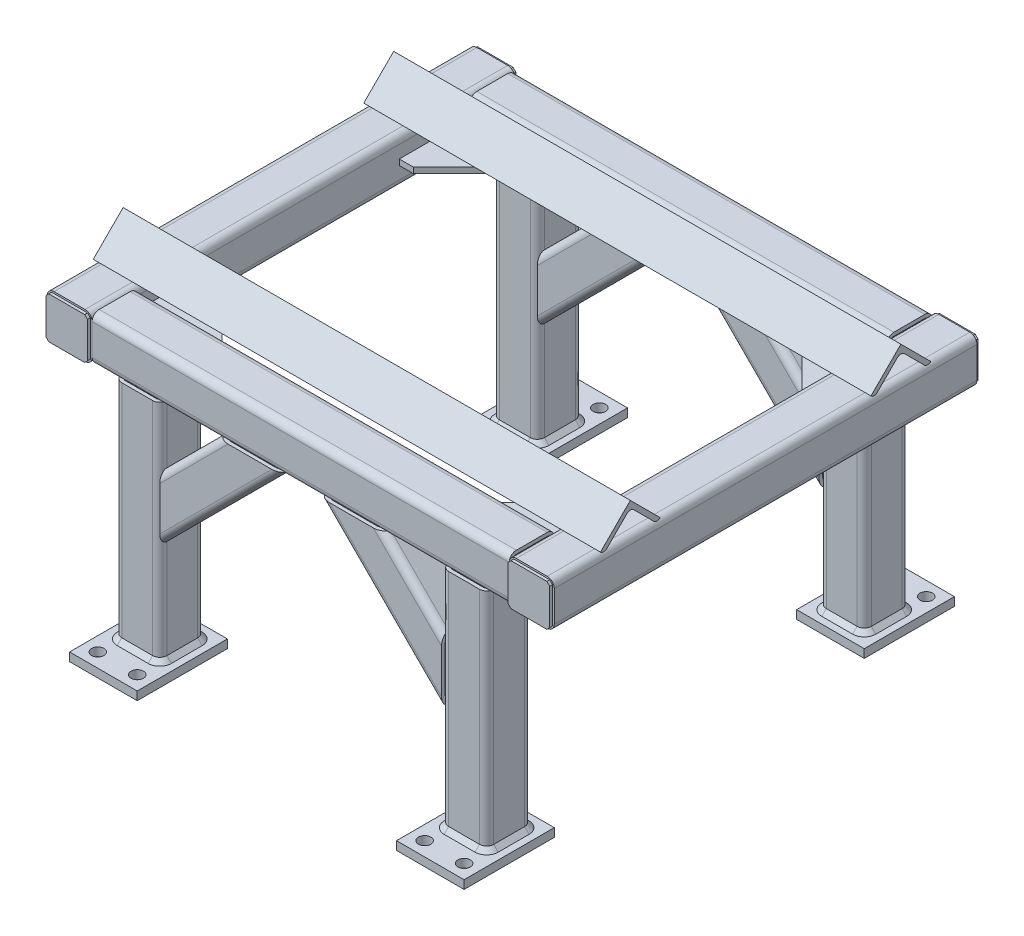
SolidWorks part; units mm, degrees
other "DetailItem1"
other "DetailItem13"
other "DetailItem2"
other "DetailItem3"
other "DetailItem4"
other "DetailItem5"
other "DetailItem6"
other "DetailItem7"
other "DetailItem8"
other "DetailItem9"
other "DetailItem10"
other "DetailItem11"
other "DetailItem12"
other "Weld Folder"
other "Weld Bead1"
other "Weld Bead2"
other "Weld Bead3"
other "Weld Bead4"
other "Weld Bead5"
other "Weld Bead6"
other "Weld Bead7"
other "Weld Bead12"
other "Weld Bead8"
other "Weld Bead9"
other "Weld Bead10"
other "Weld Bead11"
ref_plane "Default Plane" through (350, 20, -275) normal (0, -1, 0) x (-1, 0, 0)
sketch3d "Bounding-Box_BASE PLATES"
  line L0 (120, 0, 0) -> (120, 160, 0) construction
  line L1 (120, 160, 0) -> (0, 160, 0) construction
  line L2 (0, 160, 0) -> (0, 0, 0) construction
  line L3 (0, 0, 0) -> (120, 0, 0) construction
  line L4 (120, 0, 15) -> (120, 160, 15) construction
  line L5 (120, 160, 15) -> (0, 160, 15) construction
  line L6 (0, 160, 15) -> (0, 0, 15) construction
  line L7 (0, 0, 15) -> (120, 0, 15) construction
  line L8 (120, 0, 0) -> (120, 0, 15) construction
  line L9 (120, 160, 0) -> (120, 160, 15) construction
  line L10 (0, 160, 0) -> (0, 160, 15) construction
  line L11 (0, 0, 0) -> (0, 0, 15) construction
ref_plane "Default Plane" through (370, 455, -270) normal (0, 1, 0) x (-1, 0, 0)
sketch3d "Bounding-Box_GUSSETS"
  line L0 (125, -25, 0) -> (125, 100, 0) construction
  line L1 (125, 100, 0) -> (0, 100, 0) construction
  line L2 (0, 100, 0) -> (0, -25, 0) construction
  line L3 (0, -25, 0) -> (125, -25, 0) construction
  line L4 (125, -25, 10) -> (125, 100, 10) construction
  line L5 (125, 100, 10) -> (0, 100, 10) construction
  line L6 (0, 100, 10) -> (0, -25, 10) construction
  line L7 (0, -25, 10) -> (125, -25, 10) construction
  line L8 (125, -25, 0) -> (125, -25, 10) construction
  line L9 (125, 100, 0) -> (125, 100, 10) construction
  line L10 (0, 100, 0) -> (0, 100, 10) construction
  line L11 (0, -25, 0) -> (0, -25, 10) construction
ref_plane "Default Plane" through (446.85, 491.85, -380) normal (0, 0, 1) x (1, 0, 0)
sketch3d "Bounding-Box_END CAPS"
  line L0 (-73.7, -68.7, 0) -> (0, -68.7, 0) construction
  line L1 (0, -68.7, 0) -> (0, 5, 0) construction
  line L2 (0, 5, 0) -> (-73.7, 5, 0) construction
  line L3 (-73.7, 5, 0) -> (-73.7, -68.7, 0) construction
  line L4 (-73.7, -68.7, 5) -> (0, -68.7, 5) construction
  line L5 (0, -68.7, 5) -> (0, 5, 5) construction
  line L6 (0, 5, 5) -> (-73.7, 5, 5) construction
  line L7 (-73.7, 5, 5) -> (-73.7, -68.7, 5) construction
  line L8 (-73.7, -68.7, 0) -> (-73.7, -68.7, 5) construction
  line L9 (0, -68.7, 0) -> (0, -68.7, 5) construction
  line L10 (0, 5, 0) -> (0, 5, 5) construction
  line L11 (-73.7, 5, 0) -> (-73.7, 5, 5) construction
ref_plane "Front Plane" through (0, 0, 0) normal (0, 0, 1) x (1, 0, 0)
ref_plane "Top Plane" through (0, 0, 0) normal (0, 1, 0) x (1, 0, 0)
ref_plane "Right Plane" through (0, 0, 0) normal (1, 0, 0) x (0, 0, -1)
ref_plane "Top of Frame" through (0, 500, 0) normal (0, 1, 0) x (1, 0, 0)
ref_plane "Bottom of Legs" through (0, 20, 0) normal (0, 1, 0) x (1, 0, 0)
sketch "Upper Frame" plane through (0, 500, 0) normal (0, 1, 0) x (1, 0, 0)
  line L0 (-450, 375) -> (450, -375) construction
  line L1 (450, 375) -> (-450, 375)
  line L2 (450, 375) -> (450, -375)
  line L3 (450, -375) -> (-450, -375)
  line L4 (-450, 375) -> (-450, -375)
  dimension "D1" = 900
  dimension "D2" = 750
ref_plane "Front of Frame" through (0, 0, 375) normal (0, 0, 1) x (1, 0, 0)
sketch "Leg Sketch" plane through (0, 0, 375) normal (0, 0, 1) x (1, 0, 0)
  line L0 (-290, 20) -> (-290, 500)
  line L1 (0, 429.9862) -> (0, 0) construction
  line L2 (-290, 220) -> (-10, 500)
  line L3 (450, 500) -> (-450, 500) construction
  line L4 (50, 20) -> (-50, 20) construction
  dimension "D1" = 200
  dimension "D2" = 45
  dimension "D3" = 580
other "Tube (square) 80 X 80 X 6.3(1)"
ref_plane "Plane2" through (410, 460, -375) normal (0, 0, 1) x (1, 0, 0)
sketch "Sketch1" plane through (410, 460, -375) normal (0, 0, 1) x (1, 0, 0)
  line L0 (-27.4, -33.7) -> (27.4, -33.7)
  line L1 (-33.7, -27.4) -> (-33.7, 27.4)
  line L2 (27.4, 33.7) -> (-27.4, 33.7)
  line L3 (33.7, 27.4) -> (33.7, -27.4)
  line L4 (-27.4, -40) -> (27.4, -40)
  line L5 (-40, -27.4) -> (-40, 27.4)
  line L6 (27.4, 40) -> (-27.4, 40)
  line L7 (40, 27.4) -> (40, -27.4)
  line L8 (-40, 0) -> (-33.7, 0) construction
  line L9 (-33.7, 0) -> (33.7, 0) construction
  line L10 (33.7, 0) -> (40, 0) construction
  line L12 (0, 40) -> (0, 33.7) construction
  line L13 (0, 33.7) -> (0, -33.7) construction
  line L14 (0, -33.7) -> (0, -40) construction
  arc A0 (40, 27.4) -> (27.4, 40) centre (27.4, 27.4) ccw
  arc A1 (27.4, -40) -> (40, -27.4) centre (27.4, -27.4) ccw
  arc A2 (-40, -27.4) -> (-27.4, -40) centre (-27.4, -27.4) ccw
  arc A3 (-27.4, 40) -> (-40, 27.4) centre (-27.4, 27.4) ccw
  arc A4 (-27.4, 33.7) -> (-33.7, 27.4) centre (-27.4, 27.4) ccw
  arc A5 (33.7, 27.4) -> (27.4, 33.7) centre (27.4, 27.4) ccw
  arc A6 (27.4, -33.7) -> (33.7, -27.4) centre (27.4, -27.4) ccw
  arc A7 (-33.7, -27.4) -> (-27.4, -33.7) centre (-27.4, -27.4) ccw
  point P2 (-40, 40)
  point P33 (-40, -40)
  point P34 (40, -40)
  point P36 (40, 40)
  point P37 (0, 0)
  dimension "D1" = 12.6
  dimension "Thickness" = 6.3
  dimension "V_leg" = 80
  dimension "H_leg" = 80
sketch "Sketch2" plane through (0, 20, 0) normal (0, 1, 0) x (1, 0, 0)
  line L0 (-290, -375) -> (-290, -435) construction
  line L1 (-350, -435) -> (-230, -435)
  line L2 (-350, -435) -> (-350, -275)
  line L3 (-350, -275) -> (-230, -275)
  line L4 (-230, -435) -> (-230, -275)
  dimension "D1" = 120
  dimension "D2" = 160
  dimension "D3" = 60
extrude "Boss-Extrude1" add sketch "Sketch2" against normal blind 20 separate body
hole_wizard "M20 Clearance Hole1" positions "Sketch3" profile "Sketch4" hole size "M20" standard "ANSI Metric"
sketch "Sketch3" plane through (0, 20, 0) normal (0, 1, 0) x (1, 0, 0)
  line L0 (-325, -410) -> (-255, -410) construction
  line L3 (-290, -375) -> (-290, -410) construction
  line L4 (-317.4, -375) -> (-262.6, -375) construction
  line L6 (-350, -435) -> (-230, -435) construction
  point P0 (-325, -410)
  point P2 (-255, -410)
  dimension "D1" = 25
  dimension "D2" = 70
sketch "Sketch4" plane through (-325, 20, 410) normal (1, 0, 0) x (0, 0, 1)
  line L0 (0, 0) -> (0, 20)
  line L1 (0, 20) -> (11, 20)
  line L2 (11, 20) -> (11, 0)
  line L5 (11, 0) -> (0, 0)
  line L11 (0, -6.35) -> (0, 107.95) construction
  dimension "Thru Hole Dia." = 22
  dimension "Thru Hole Depth" = 20
other "Gusset1" parameters "D1"=10, "D2"=10, "D3"=0, "D4"=0, "D10"=5, "D11"=125, "D12"=125, "D13"=25, "D14"=45, "D15"=25, "D16"=25, "D17"=25, "D18"=45
sketch "Sketch5" plane through (-370, 460, 295) normal (0, 1, 0) x (1, 0, 0)
  line L0 (0, 25) -> (0, 125)
  line L1 (25, 0) -> (125, 0)
  line L2 (0, 25) -> (25, 0)
  line L3 (25, 125) -> (125, 25)
  line L4 (0, 125) -> (25, 125)
  line L5 (125, 0) -> (125, 25)
other "End cap1" parameters "D1"=5, "D2"=3, "D3"=5
other "Fillet Bead1" parameters "D10"=6, "D11"=8, "D12"=0, "D13"=3, "D14"=0
mirror "Mirror1" about plane through (0, 0, 0) normal (1, 0, 0)
mirror "Mirror2" about plane through (0, 0, 0) normal (0, 0, 1)
sketch "Rails Sketch" plane through (0, 500, 0) normal (0, 1, 0) x (1, 0, 0)
  line L0 (-450, 0) -> (450, 0) construction
  line L1 (-450, 375) -> (-450, -375) construction
  line L2 (450, -375) -> (450, 375) construction
  line L3 (-450, -240) -> (450, -240)
  line L4 (-450, 240) -> (450, 240)
  line L5 (-450, 375) -> (-450, -375) construction
  dimension "D1" = 480
other "L angle (equal) MODIFIED_75X75X8(1)"
ref_plane "Plane4" through (-450, 555.3762, 240) normal (1, 0, 0) x (0, -0.7071, 0.7071)
sketch "Sketch12" plane through (-450, 555.3762, 240) normal (1, 0, 0) x (0, -0.7071, 0.7071)
  line L0 (0, 75) -> (0, 0)
  line L1 (5.6569, 72.6569) -> (72.6569, 5.6569) construction
  line L2 (8, 67) -> (8, 17)
  line L3 (17, 8) -> (67, 8)
  line L5 (75, 0) -> (0, 0)
  arc A0 (8, 67) -> (0, 75) centre (0, 67) ccw
  arc A1 (75, 0) -> (67, 8) centre (67, 0) ccw
  arc A2 (17, 8) -> (8, 17) centre (17, 17) cw
  point P8 (0, 37.5)
  point P9 (37.5, 0)
  point P11 (39.1569, 39.1569)
  point P16 (0, 0)
  dimension "Radius_2" = 8
  dimension "Radius_1" = 9
  dimension "V_leg" = 75
  dimension "H_leg" = 75
  dimension "thickness" = 8
sketch "Sketch13" plane through (0, 0, 0) normal (0, 0, 1) x (1, 0, 0)
  line L0 (-350, 5) -> (350, 5)
  line L1 (-350, 0) -> (-350, 20) construction
  line L2 (350, 0) -> (350, 20) construction
  line L3 (437.4, 500) -> (382.6, 500) construction
  dimension "D1" = 495
extrude "Cut-Extrude1" cut sketch "Sketch13" against normal through all both and the other way through all flip side to cut
